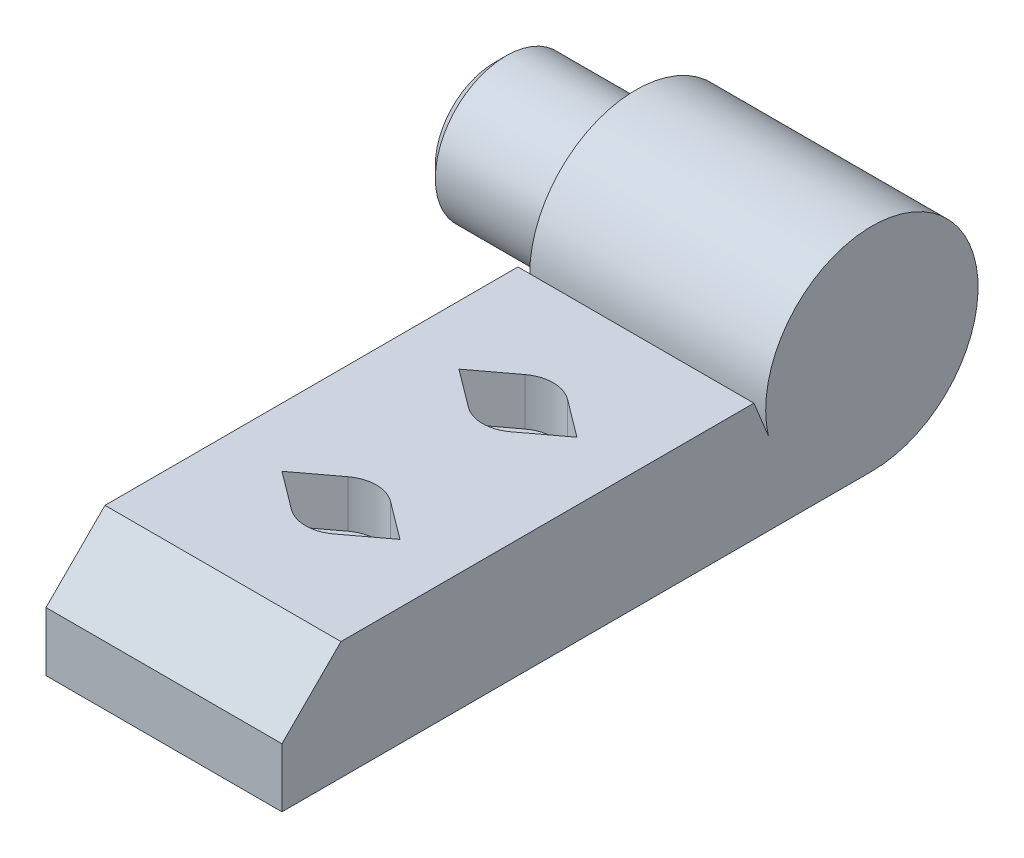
SolidWorks part; units mm, degrees
ref_plane "Front Plane" through (0, 0, 0) normal (0, 0, 1) x (1, 0, 0)
ref_plane "Top Plane" through (0, 0, 0) normal (0, 1, 0) x (1, 0, 0)
ref_plane "Right Plane" through (0, 0, 0) normal (1, 0, 0) x (0, 0, -1)
sketch "Sketch1" plane through (0, 0, 0) normal (1, 0, 0) x (0, 0, -1)
  line L0 (0, 0) -> (50, 0)
  line L1 (50, 0) -> (50, 18) construction
  line L2 (50, 18) -> (40, 18) construction
  line L3 (40, 18) -> (40, 10) construction
  line L4 (40, 10) -> (5, 10)
  line L5 (0, 5) -> (0, 0)
  line L6 (0, 5) -> (5, 10)
  line L7 (40, 10) -> (41.225, 7)
  arc A0 (50, 0) -> (41.225, 7) centre (50, 9) ccw
  dimension "D2" = 50
  dimension "D3" = 18
  dimension "D1" = 10
  dimension "D4" = 5
  dimension "D5" = 5
  dimension "D6" = 35
  dimension "D7" = 3
extrude "Boss-Extrude1" add sketch "Sketch1" against normal blind 20
sketch "Sketch2" plane through (0, 10, 0) normal (0, 1, 0) x (1, 0, 0)
  line L0 (0, 0) -> (-20, 0) construction
  line L1 (-10, 0) -> (-10, 30) construction
  circle A0 centre (-10, 30) radius 1.75
  circle A1 centre (-10, 15) radius 1.75
  dimension "D1" = 3.5
  dimension "D2" = 15
  dimension "D3" = 30
extrude "Cut-Extrude1" cut sketch "Sketch2" against normal up to next
sketch "Sketch3" plane through (0, 10, 0) normal (0, 1, 0) x (1, 0, 0)
  circle A0 centre (-10, 30) radius 3
  circle A1 centre (-10, 15) radius 3
  dimension "D1" = 6
extrude "Cut-Extrude2" cut sketch "Sketch3" against normal blind 4
sketch "Sketch4" plane through (-20, 0, 0) normal (-1, 0, 0) x (0, 0, 1)
  circle A0 centre (-50, 9) radius 6
  dimension "D1" = 12
extrude "Boss-Extrude2" add sketch "Sketch4" along normal blind 12
chamfer "Chamfer1" distance 1 angle 45 1 edges at (-32, 9, -44)
sketch "Sketch5" [suppressed] plane through (0, 0, 0) normal (1, 0, 0) x (0, 0, -1)
  circle A0 centre (60, 9) radius 6
  dimension "D1" = 12
extrude "Boss-Extrude3" [suppressed] add sketch "Sketch5" along normal blind 12
chamfer "Chamfer2" [suppressed] distance 1 angle 45
sketch "Sketch6" plane through (0, 10, 0) normal (0, 1, 0) x (1, 0, 0)
  line L0 (-5, 30) -> (-15, 30) construction
  line L1 (-10, 30) -> (-10, 15) construction
  line L2 (-10, 22.5) -> (-14.7357, 22.5) construction
  line L3 (-15, 30) -> (-11.8, 27.6)
  line L4 (-15, 30) -> (-11.8, 32.4)
  line L5 (-5, 30) -> (-8.2, 32.4)
  line L6 (-5, 30) -> (-8.2, 27.6)
  line L7 (-15, 15) -> (-11.8, 12.6)
  line L8 (-5, 15) -> (-8.2, 12.6)
  line L9 (-5, 15) -> (-8.2, 17.4)
  line L10 (-15, 15) -> (-11.8, 17.4)
  circle A0 centre (-10, 30) radius 3 construction
  circle A1 centre (-10, 30) radius 3 construction
  arc A2 (-11.8, 27.6) -> (-8.2, 27.6) centre (-10, 30) ccw
  arc A3 (-8.2, 32.4) -> (-11.8, 32.4) centre (-10, 30) ccw
  arc A4 (-8.2, 12.6) -> (-11.8, 12.6) centre (-10, 15) cw
  arc A5 (-11.8, 17.4) -> (-8.2, 17.4) centre (-10, 15) cw
  point P5 (-10, 30)
  dimension "D1" = 10
extrude "Cut-Extrude3" cut sketch "Sketch6" against normal up to surface (4 mm away)
